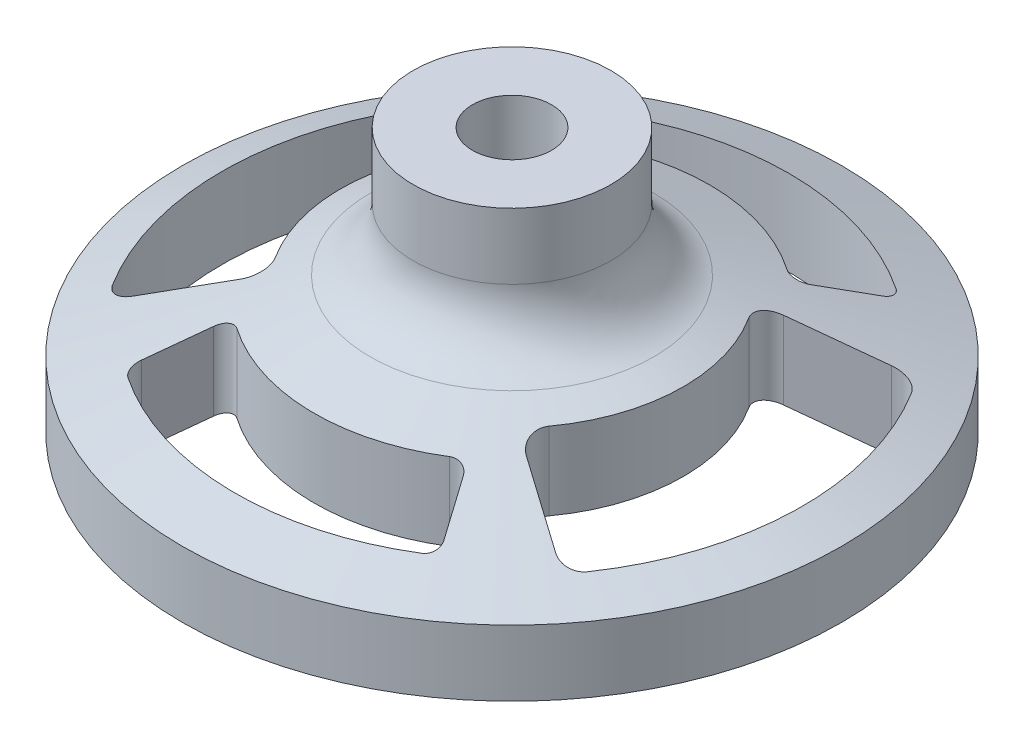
SolidWorks part; units mm, degrees
ref_plane "Front" through (0, 0, 0) normal (0, 0, 1) x (1, 0, 0)
ref_plane "Top" through (0, 0, 0) normal (0, 1, 0) x (1, 0, 0)
ref_plane "Right" through (0, 0, 0) normal (1, 0, 0) x (0, 0, -1)
sketch "Sketch1" plane through (0, 0, 0) normal (0, 0, 1) x (1, 0, 0)
  line L0 (0, 0) -> (0, 300) construction
  line L1 (30, 73.1162) -> (30, 200)
  line L2 (30, 200) -> (75, 200)
  line L3 (75, 200) -> (75, 150)
  line L4 (107.5231, 103.1539) -> (250, 50)
  line L5 (250, 50) -> (250, 0)
  line L7 (250, 0) -> (200, 0)
  line L8 (200, 0) -> (200, 9)
  line L9 (199.3495, 9.9369) -> (30, 73.1162)
  arc A0 (75, 150) -> (107.5231, 103.1539) centre (125, 150) ccw
  arc A1 (200, 9) -> (199.3495, 9.9369) centre (199, 9) ccw
  point P16 (200, 4.5)
  dimension "D6" = 1
  dimension "D7" = 50
  dimension "D1" = 300
  dimension "D2" = 200
  dimension "D3" = 30
  dimension "D4" = 75
  dimension "D5" = 250
  dimension "D8" = 50
  dimension "D9" = 150
  dimension "D10" = 200
revolve "Revolve1" add sketch "Sketch1" angle 360 about L0
sketch "Sketch2" plane through (0, 200, 0) normal (0, 1, 0) x (1, 0, 0)
  line L0 (0, 0) -> (0, -272.2377) construction
  line L1 (-119.4371, -161.5188) -> (-99.3867, -126.7904)
  line L2 (113.6375, -165.2345) -> (93.6269, -130.5753)
  arc A0 (110.2261, -178.7462) -> (-116.3157, -174.8447) centre (0, 0) cw
  arc A1 (-85.056, -123.5535) -> (79.6563, -127.1018) centre (0, 0) ccw
  arc A2 (-116.3157, -174.8447) -> (-119.4371, -161.5188) centre (-110.7768, -166.5188) cw
  arc A3 (-85.056, -123.5535) -> (-99.3867, -126.7904) centre (-90.7264, -131.7904) ccw
  arc A4 (79.6563, -127.1018) -> (93.6269, -130.5753) centre (84.9667, -135.5753) cw
  arc A5 (110.2261, -178.7462) -> (113.6375, -165.2345) centre (104.9772, -170.2345) ccw
  dimension "D1" = 210
  dimension "D2" = 150
  dimension "D5" = 10
  dimension "D3" = 30
  dimension "D4" = 30
extrude "Cut-Extrude1" cut sketch "Sketch2" against normal through all
pattern_circular "CirPattern1" count 2 every 180 about axis through (0, 0, 0) along (0, 1, 0) of "Cut-Extrude1"
sketch "Sketch3" plane through (0, 200, 0) normal (0, 1, 0) x (1, 0, 0)
  line L0 (0, 0) -> (388.8155, 0) construction
  line L1 (109.5422, -98.5832) -> (161.7179, -128.7068)
  line L2 (166.7039, 121.0552) -> (114.7056, 91.0339)
  arc A0 (181.5997, -124.1835) -> (186.9505, 115.972) centre (0, 0) ccw
  arc A1 (104.9344, -76.7384) -> (109.5636, 69.9701) centre (0, 0) ccw
  arc A2 (186.9505, 115.972) -> (166.7039, 121.0552) centre (174.2039, 108.0648) ccw
  arc A3 (109.5636, 69.9701) -> (114.7056, 91.0339) centre (122.2056, 78.0436) cw
  arc A4 (104.9344, -76.7384) -> (109.5422, -98.5832) centre (117.0422, -85.5928) ccw
  arc A5 (181.5997, -124.1835) -> (161.7179, -128.7068) centre (169.2179, -115.7165) cw
  dimension "D3" = 130
  dimension "D4" = 220
  dimension "D5" = 15
  dimension "D1" = 30
  dimension "D2" = 30
extrude "Cut-Extrude2" cut sketch "Sketch3" against normal through all and the other way through all
pattern_circular "CirPattern2" count 2 every 180 about axis through (0, 0, 0) along (0, 1, 0) of "Cut-Extrude2"
